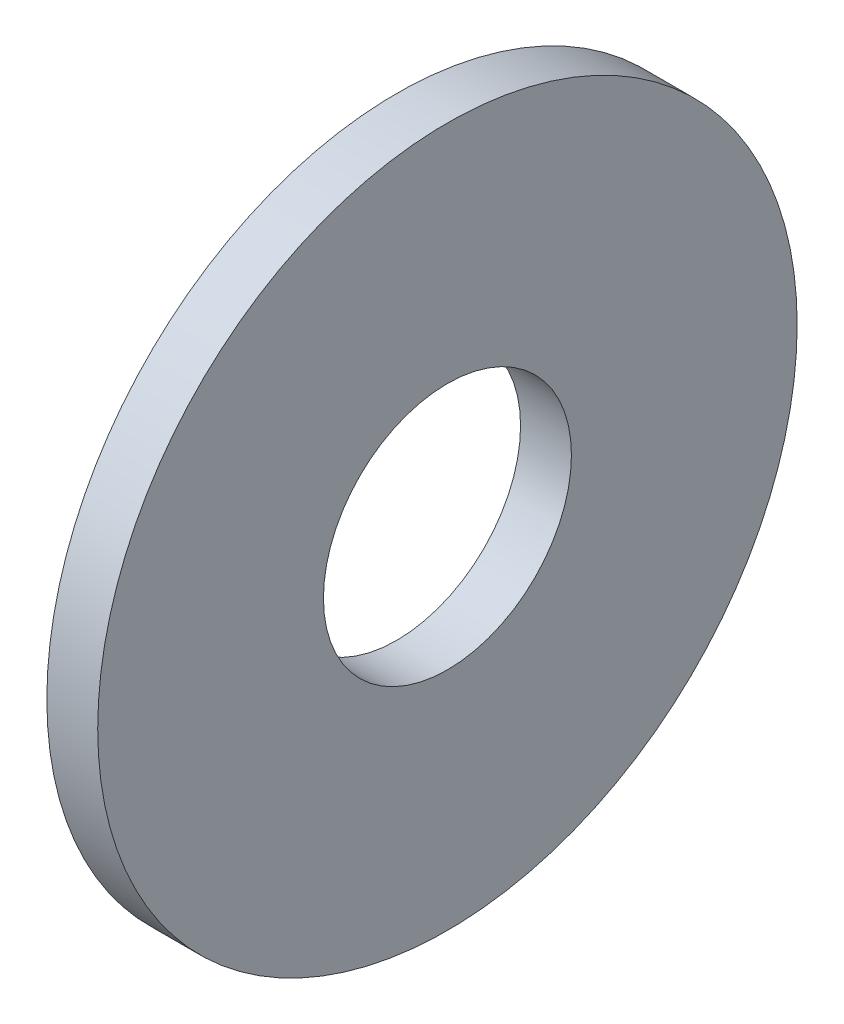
SolidWorks part; units mm, degrees
ref_plane "Plane1" through (0, 0, 0) normal (0, 0, 1) x (1, 0, 0)
ref_plane "Plane2" through (0, 0, 0) normal (0, 1, 0) x (1, 0, 0)
ref_plane "Plane3" through (0, 0, 0) normal (1, 0, 0) x (0, 0, -1)
other "Configuration Table"
sketch "Sketch1" plane through (0, 0, 0) normal (0, 0, 1) x (1, 0, 0)
  line L0 (-34.925, 0) -> (9.525, 0) construction
  line L1 (0, 19.5) -> (0, 55)
  line L2 (0, 55) -> (-8, 55)
  line L3 (-8, 55) -> (-8, 19.5)
  line L4 (-8, 19.5) -> (0, 19.5)
  dimension "Thickness" = 8
  dimension "Inside_dia" = 39
  dimension "Outside_dia" = 110
revolve "Base-Revolve" add sketch "Sketch1" angle 360 about L0
